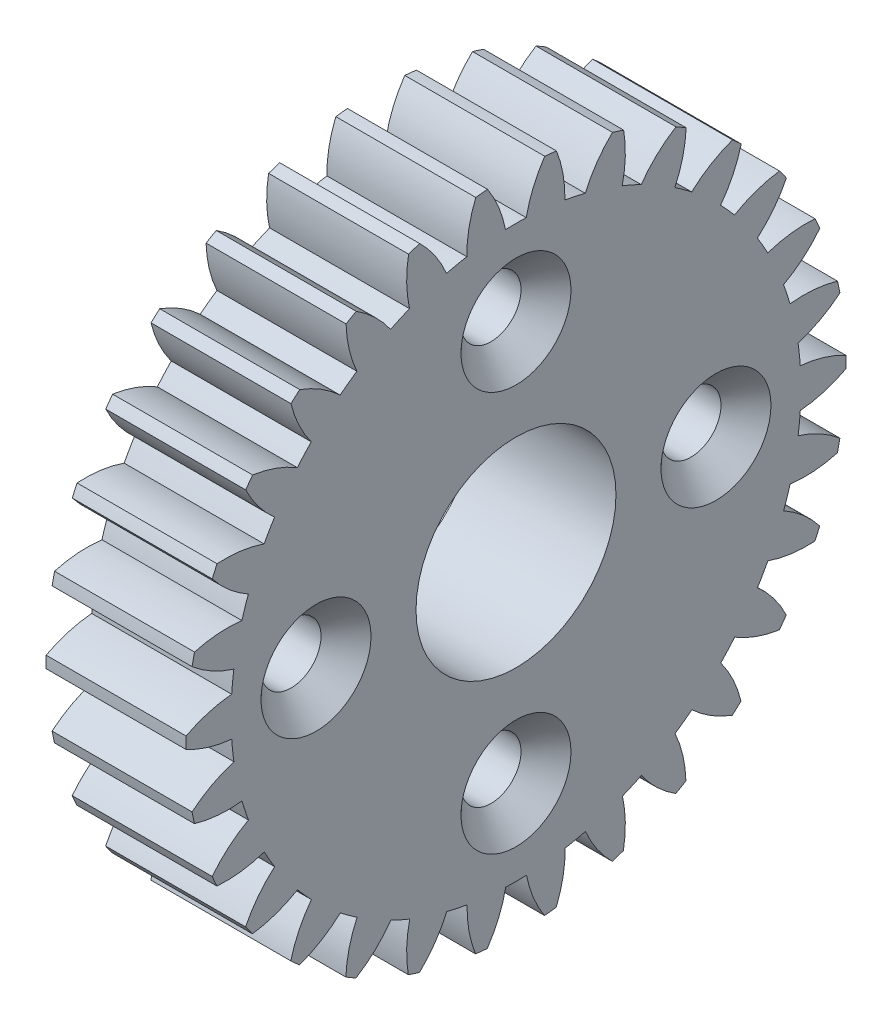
SolidWorks part; units mm, degrees
ref_plane "Plane1" through (0, 0, 0) normal (0, 0, 1) x (1, 0, 0)
ref_plane "Plane2" through (0, 0, 0) normal (0, 1, 0) x (1, 0, 0)
ref_plane "Plane3" through (0, 0, 0) normal (1, 0, 0) x (0, 0, -1)
other "Configuration Table"
sketch "HoldingSke" plane through (0, 0, 0) normal (0, 1, 0) x (1, 0, 0)
  line L0 (0, 0) -> (0.866, -0.5)
  line L1 (-15, 0) -> (100, 0) construction
  line L2 (0, 0) -> (-2.1039, 2.3779)
  line L3 (0, 0) -> (-11.863, 4.5341)
  line L4 (0, 0) -> (7.479, 4.318)
  line L5 (0, 0) -> (-47.7846, -17.8222)
  line L6 (0, 0) -> (-5.8027, -3.9151)
  line L7 (-2.1039, 2.3779) -> (8.8744, 52.1848)
  line L8 (-76.2, 54.61) -> (-74.4, 54.61)
  line L9 (-71.009, 38.7566) -> (-53.1078, 45.2721)
  line L10 (-76.2, 71.12) -> (104.1128, 71.12)
  line L11 (0, 0) -> (-10, 0)
  line L12 (-76.2, 101.6) -> (-76.162, 101.6)
  line L13 (24.9733, 27.94) -> (52.9518, 28.4284)
  line L14 (24.9733, 27.94) -> (24.9743, 27.94)
  line L15 (24.9733, 27.94) -> (100.4006, 29.5858)
  line L16 (-63.627, -1) -> (-12.827, -1)
  circle A0 centre (0, 0) radius 5
  circle A1 centre (0, 0) radius 13.749
  circle A2 centre (0, 0) radius 38.5
  circle A3 centre (0, 0) radius 5
sketch "BasProSke" plane through (0, 0, 0) normal (0, 1, 0) x (1, 0, 0)
  line L0 (-10, 0) -> (60, 0) construction
  line L1 (0, 0) -> (0, 16.5)
  line L2 (0, 0) -> (7, 0)
  line L3 (7, 0) -> (7, 16.5)
  line L4 (7, 16.5) -> (0, 16.5)
revolve "Base-Revolve" add sketch "BasProSke" angle 360 about L0
sketch "TooCutSke" plane through (0, 0, 0) normal (1, 0, 0) x (0, 0, -1)
  line L2 (0, 0) -> (-0.9038, 15.4736) construction
  line L3 (0, 0) -> (-3.2369, 30.797) construction
  line L4 (-0.9038, 15.4736) -> (-1.6184, 15.3985) construction
  arc A0 (0.5129, 14.2398) -> (-0.5256, 14.2393) centre (0, 0) ccw
  arc A1 (1.4389, 16.4371) -> (-1.4267, 16.4382) centre (0, 0) ccw
  circle A2 centre (0, 0) radius 15.5 construction
  circle A3 centre (0, 0) radius 14.5955 construction
  arc A4 (-0.5256, 14.2393) -> (-1.4267, 16.4382) centre (-6.4181, 13.1087) ccw
  arc A5 (1.4389, 16.4371) -> (0.5129, 14.2398) centre (6.3948, 13.0551) ccw
extrude "ToothCut" cut sketch "TooCutSke" along normal through all
fillet "Breaks" [suppressed] radius 0.02
fillet "RootFillets" [suppressed] radius 0.251
pattern_circular "TeethCuts" count 30 every 12 about axis through (-10, 0, 0) along (1, 0, 0) of "ToothCut", "RootFillets", "Breaks"
sketch "HubNeaOneSke" plane through (0, 0, 0) normal (-1, 0, 0) x (0, 0, 1)
  circle A0 centre (0, 0) radius 13.749
extrude "HubNearOne" [suppressed] add sketch "HubNeaOneSke" along normal blind 44.0024
sketch "HubNeaBotSke" plane through (0, 0, 0) normal (-1, 0, 0) x (0, 0, 1)
  circle A0 centre (0, 0) radius 13.749
extrude "HubNearBoth" [suppressed] add sketch "HubNeaBotSke" along normal blind 22.0012
ref_plane "FarPln" through (7, 0, 0) normal (1, 0, 0) x (0, 0, -1)
sketch "HubFarSke" plane through (7, 0, 0) normal (1, 0, 0) x (0, 0, -1)
  circle A0 centre (0, 0) radius 13.749
extrude "HubFar" [suppressed] add sketch "HubFarSke" along normal blind 22.0012
sketch "BorSke" plane through (0, 0, 0) normal (1, 0, 0) x (0, 0, -1)
  circle A0 centre (0, 0) radius 5
extrude "Bore" cut sketch "BorSke" along normal mid plane 102.0049
sketch "KeySke" plane through (0, 0, 0) normal (1, 0, 0) x (0, 0, -1)
  line L0 (-2, 0) -> (-2, 6.8)
  line L1 (-2, 6.8) -> (2, 6.8)
  line L2 (2, 6.8) -> (2, 0)
  line L3 (0, 0) -> (0, 34) construction
  line L4 (-2, 0) -> (2, 0)
extrude "Keyway" [suppressed] cut sketch "KeySke" along normal mid plane 102.0049
pattern_circular "Keyway2" [suppressed] count 2 every 90 about axis through (-10, 0, 0) along (1, 0, 0)
sketch "Sketch2" plane through (7, 0, 0) normal (1, 0, 0) x (0, 0, -1)
  line L0 (-10, 0) -> (10, 0) construction
  line L1 (0, 10) -> (0, -10) construction
hole_wizard "CSK for M2.5 Countersunk Flat Head Screw1" positions "Sketch6" profile "Sketch4" countersink size "M2.5" standard "ISO"
sketch "Sketch6" plane through (7, 0, 0) normal (1, 0, 0) x (0, 0, -1)
  point P0 (-10, 0)
  point P3 (0, -10)
  point P6 (10, 0)
  point P10 (0, 10)
sketch "Sketch4" plane through (7, 0, 10) normal (0, 1, 0) x (0, 0, -1)
  line L0 (0, 0) -> (0, 7)
  line L1 (0, 7) -> (1.45, 7)
  line L2 (1.45, 7) -> (1.45, 1.3)
  line L3 (1.45, 1.3) -> (2.75, 0)
  line L5 (2.75, 0) -> (0, 0)
  line L6 (-1.45, 1.3) -> (-2.75, 0) construction
  line L11 (0, -6.35) -> (0, 107.95) construction
  dimension "Thru Hole Dia." = 2.9
  dimension "Thru Hole Depth" = 7
  dimension "Near C'Sink Dia." = 5.5
  dimension "Near C'Sink Angle" = 90
sketch "Sketch11" plane through (7, 0, 0) normal (1, 0, 0) x (0, 0, -1)
  circle A0 centre (0, 0) radius 16.5
sketch "Sketch17" plane through (7, 0, 0) normal (1, 0, 0) x (0, 0, -1)
  circle A0 centre (0, 10) radius 1.5
  circle A1 centre (-10, 0) radius 1.5
  circle A2 centre (10, 0) radius 1.5
  circle A3 centre (0, -10) radius 1.5
  dimension "D1" = 3
extrude "Cut-Extrude1" cut sketch "Sketch17" against normal blind 10
equation "' \"Module@HoldingSke\" = 6.35"
equation "'\"Num_teeth@HoldingSke\" = 12.4"
equation "' \"Ap@HoldingSke\" =  20"
equation "' \"Ap@HoldingSke\" = 20"
equation "' \"Width@HoldingSke\" = 0.5 * 25.4"
equation "' \"Hub_dia@HoldingSke\"= 1 * 25.4"
equation "' \"Hub_dia@HoldingSke\" = 1 * 25.4"
equation "' \"Overall_len@HoldingSke\" = 1.0 * 25.4"
equation "' \"Bore@HoldingSke\" = 0.75 * 25.4"
equation "' \"T_dim@HoldingSke\" = 0.1 * 25.4"
equation "' \"Width@KeySke\" = 0.25 * 25.4"
equation "' \"Show_teeth@HoldingSke\" = 13"
equation "' \"Backlash@HoldingSke\" = 0.009 * 25.4"
equation "'\"Addendum_fac@HoldingSke\" =1.5"
equation "'\"Addendum_fac@HoldingSke\" = 1.5"
equation "' \"Dedendum_fac@HoldingSke\" = 1.25"
equation "' \"Dedendum_add@HoldingSke\" = 0.00005 * 25.4"
equation "' \"Clearance_fac@HoldingSke\" = 0.25"
equation "\"Pitch@HoldingSke\" = 1 / \"Module@HoldingSke\""
equation "\"Half_CT@TooCutSke\" = \"Num_teeth@HoldingSke\" / \"Pitch@HoldingSke\" * sin((3.14159265 / 2 / \"Num_teeth@HoldingSke\")) / 2 - 7 * \"Backlash@HoldingSke\" / 4"
equation "\"Flank_rad@TooCutSke\" = \"Num_teeth@HoldingSke\" / \"Pitch@HoldingSke\" / 5"
equation "\"Radius@RootFillets\" = \"Clearance_fac@HoldingSke\" / \"Pitch@HoldingSke\" + \"Dedendum_add@HoldingSke\""
equation "\"Break_rad@Breaks\" = 0.02 / \"Pitch@HoldingSke\""
equation "\"OAL@HoldingSke\" = \"Thickness@HoldingSke\""
equation "\"MHD@HoldingSke\" = (\"Num_teeth@HoldingSke\" + 2) / \"Pitch@HoldingSke\" - 2 * (\"Addendum_fac@HoldingSke\" + \"Dedendum_fac@HoldingSke\")  / \"Pitch@HoldingSke\" - \"Dedendum_add@HoldingSke\" * 2"
equation "\"MBD@HoldingSke\" = (\"Num_teeth@HoldingSke\" + 2) / \"Pitch@HoldingSke\" - 2 * (\"Addendum_fac@HoldingSke\" + \"Dedendum_fac@HoldingSke\")  / \"Pitch@HoldingSke\" - \"Dedendum_add@HoldingSke\" * 2 - 0.002 * 25.4"
equation "\"MHD@HoldingSke\" = ((sgn( \"MHD@HoldingSke\" - \"Hub_dia@HoldingSke\" )-1)*( \"MHD@HoldingSke\" - \"Hub_dia@HoldingSke\" ))/-2+ \"Hub_dia@HoldingSke\""
equation "\"MBD@HoldingSke\" = ((sgn( \"MBD@HoldingSke\" - \"Bore@HoldingSke\" )-1)*( \"MBD@HoldingSke\" - \"Bore@HoldingSke\" ))/-2+ \"Bore@HoldingSke\""
equation "\"OAL@HoldingSke\" = ((sgn( \"OAL@HoldingSke\" - \"Overall_len@HoldingSke\" )+1)*( \"OAL@HoldingSke\" - \"Overall_len@HoldingSke\" ))/2 + \"Overall_len@HoldingSke\" + 0.000002 * 25.4"
equation "\"Num_teeth@TeethCuts\" = int( \"Show_teeth@HoldingSke\" ) + 1"
equation "\"Num_teeth@TeethCuts\" = ((sgn( \"Num_teeth@TeethCuts\" - \"Num_teeth@HoldingSke\" )-1)*( \"Num_teeth@TeethCuts\" - \"Num_teeth@HoldingSke\" ))/-2+ \"Num_teeth@HoldingSke\""
equation "\"Num_teeth@TeethCuts\" = ((sgn( \"Num_teeth@TeethCuts\" - 2.0)+1)*( \"Num_teeth@TeethCuts\" - 2.0))/2 +2.0"
equation "\"Angle@TeethCuts\" = 360.0 / \"Num_teeth@HoldingSke\""
equation "\"Thickness@BasProSke\"  = \"Thickness@HoldingSke\""
equation "' \"Fillet_rad@BasProSke\" =  \"Thickness@HoldingSke\" * 0.05"
equation "' \"Fillet_rad@BasProSke\" = \"Thickness@HoldingSke\" * 0.05"
equation "\"MHD@HoldingSke\" = ((sgn( \"MHD@HoldingSke\" - \"Root_dia@TooCutSke\" )-1)*( \"MHD@HoldingSke\" - \"Root_dia@TooCutSke\" ))/-2+ \"Root_dia@TooCutSke\""
equation "\"Diameter@HubNeaOneSke\" = \"MHD@HoldingSke\""
equation "\"Length@HubNearOne\" = \"OAL@HoldingSke\" - \"Thickness@BasProSke\""
equation "\"Diameter@HubNeaBotSke\" = \"MHD@HoldingSke\""
equation "\"Length@HubNearBoth\" = ( \"OAL@HoldingSke\" - \"Thickness@BasProSke\" ) / 2.0"
equation "\"Thickness@FarPln\" = \"Thickness@BasProSke\""
equation "\"Diameter@HubFarSke\" = \"MHD@HoldingSke\""
equation "\"Length@HubFar\" = ( \"OAL@HoldingSke\" - \"Thickness@BasProSke\" ) / 2.0"
equation "\"Diameter@BorSke\" = \"MBD@HoldingSke\""
equation "\"D1@Bore\" = \"OAL@HoldingSke\" * 2.0"
equation "\"D1@Keyway\" = \"OAL@HoldingSke\" * 2.0"
equation "\"Offset@KeySke\" = \"T_dim@HoldingSke\" + \"MBD@HoldingSke\" / 2.0"
